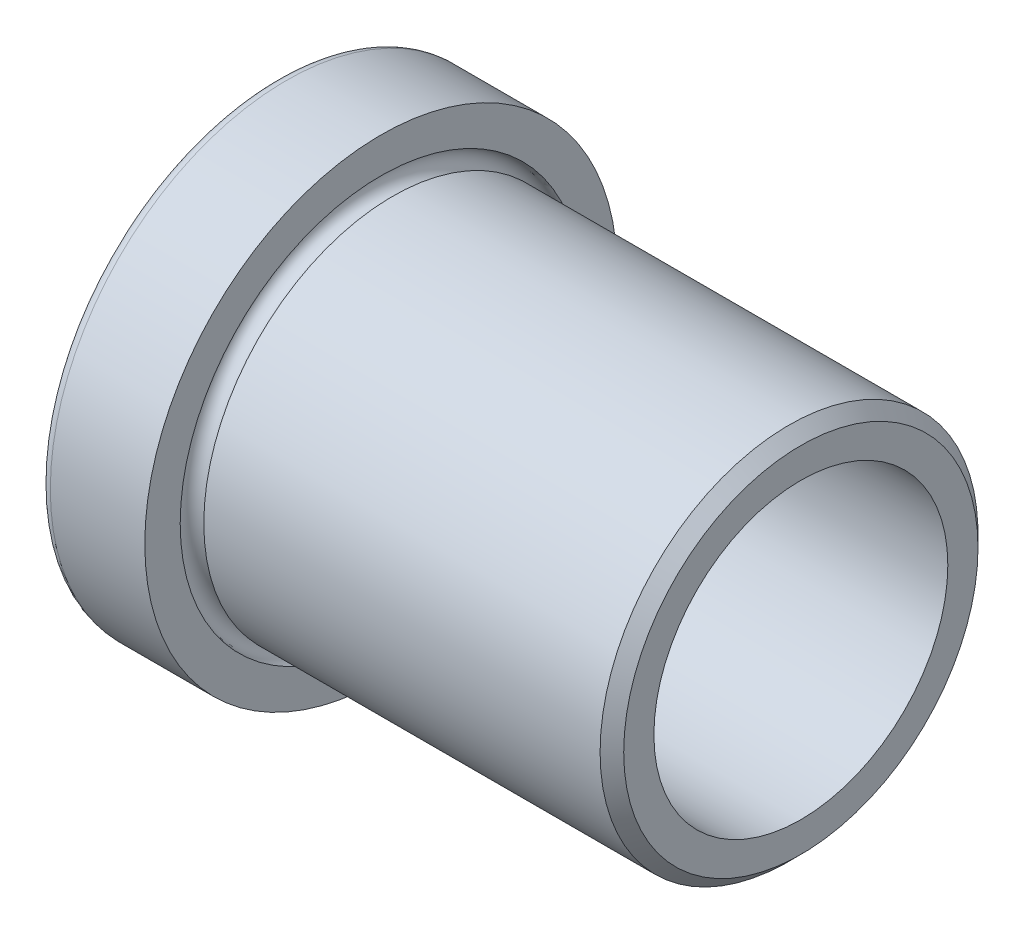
SolidWorks part; units mm, degrees
ref_plane "Plane1" through (0, 0, 0) normal (0, 0, 1) x (1, 0, 0)
ref_plane "Plane2" through (0, 0, 0) normal (0, 1, 0) x (1, 0, 0)
ref_plane "Plane3" through (0, 0, 0) normal (1, 0, 0) x (0, 0, -1)
sketch "Sketch1" plane through (0, 0, 0) normal (0, 0, 1) x (1, 0, 0)
  line L0 (0, 0) -> (76.2, 0) construction
  line L1 (0, 25.4) -> (0, 34.1249)
  line L2 (1.5875, 35.7124) -> (15.875, 35.7124)
  line L3 (15.875, 35.7124) -> (15.875, 30.3593)
  line L4 (17.6593, 28.575) -> (77.5891, 28.575)
  line L5 (77.5891, 28.575) -> (79.375, 26.7891)
  line L6 (79.375, 26.7891) -> (79.375, 22.225)
  line L7 (79.375, 22.225) -> (3.175, 22.225)
  line L8 (77.5891, -28.575) -> (79.375, -26.7891) construction
  line L9 (79.375, -22.225) -> (0, -22.225) construction
  line L10 (17.6593, -28.575) -> (77.5891, -28.575) construction
  line L11 (0, -35.7124) -> (15.875, -35.7124) construction
  arc A0 (15.875, 30.3593) -> (17.6593, 28.575) centre (15.875, 28.575) ccw
  arc A1 (0, 25.4) -> (3.175, 22.225) centre (3.175, 25.4) ccw
  arc A2 (1.5875, 35.7124) -> (0, 34.1249) centre (1.5875, 34.1249) ccw
  point P20 (0, 22.225)
  point P23 (0, 35.7124)
  dimension "Head_radius" = 3.175
  dimension "D1" = 1.7843
  dimension "D4" = 1.5875
  dimension "Hole_dia" = 44.45
  dimension "Body_dia" = 57.15
  dimension "Head_dia" = 71.4248
  dimension "Head_thickness" = 15.875
  dimension "D2" = 53.5781
  dimension "D3" = 45
  dimension "Body_len" = 63.5
revolve "BaseBody" add sketch "Sketch1" angle 360 about L0
equation "\"D2@Sketch1\" = \"Body_dia@Sketch1\" * .9375"
equation "\"D4@Sketch1\" = \"Head_radius@Sketch1\" / 2"
equation "\"D1@Sketch1\" =  (  ( \"Head_dia@Sketch1\" - \"Body_dia@Sketch1\" )  / 2 )  / 4"
